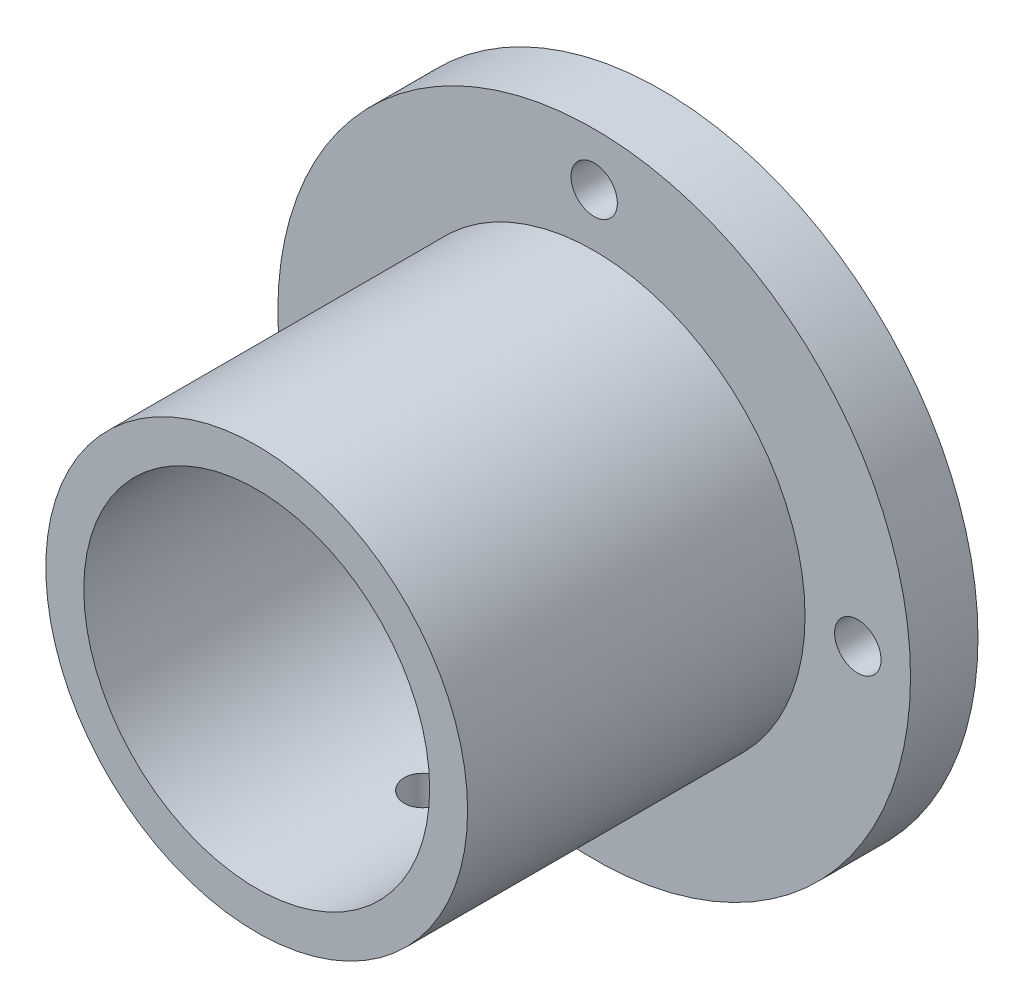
SolidWorks part; units mm, degrees
ref_plane "前视基准面" through (0, 0, 0) normal (0, 0, 1) x (1, 0, 0)
ref_plane "上视基准面" through (0, 0, 0) normal (0, 1, 0) x (1, 0, 0)
ref_plane "右视基准面" through (0, 0, 0) normal (1, 0, 0) x (0, 0, -1)
sketch "草图2" plane through (0, 0, 0) normal (0, 0, 1) x (1, 0, 0)
  circle A0 centre (0, 0) radius 37.5
  circle A1 centre (0, -31.25) radius 2.75
  circle A2 centre (31.25, 0) radius 2.75
  circle A3 centre (0, 31.25) radius 2.75
  circle A4 centre (-31.25, 0) radius 2.75
extrude "凸台-拉伸1" add sketch "草图2" along normal blind 8
sketch "草图3" plane through (0, 0, 8) normal (0, 0, 1) x (1, 0, 0)
  circle A0 centre (0, 0) radius 25
extrude "凸台-拉伸2" add sketch "草图3" along normal blind 40
sketch "草图4" plane through (0, 0, 48) normal (0, 0, 1) x (1, 0, 0)
  circle A0 centre (0, 0) radius 20.5
extrude "切除-拉伸1" cut sketch "草图4" against normal through all
ref_plane "基准面2" through (0, 10, 0) normal (0, 1, 0) x (-1, 0, 0)
sketch "草图5" plane through (0, 10, 0) normal (0, 1, 0) x (-1, 0, 0)
  line L0 (25, 48) -> (-25, 48) construction
  circle A0 centre (0, 28) radius 2.5
  dimension "D1" = 20
extrude "切除-拉伸2" cut sketch "草图5" against normal blind 40
